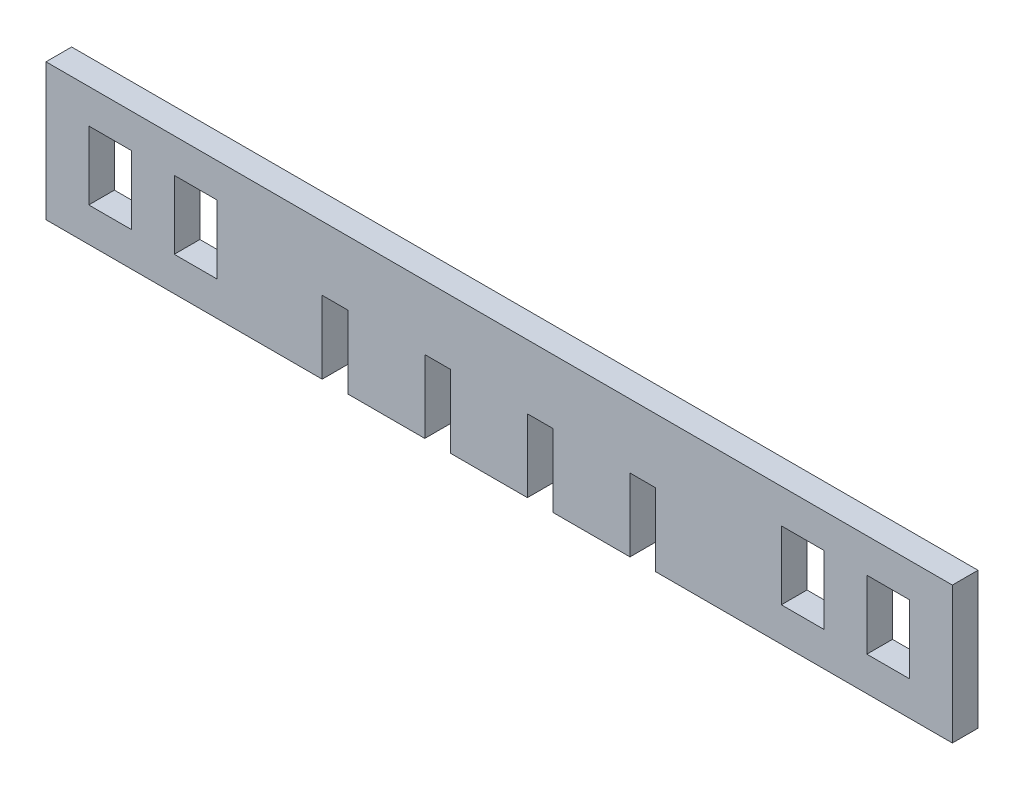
SolidWorks part; units mm, degrees
ref_plane "Alzado" through (0, 0, 0) normal (0, 0, 1) x (1, 0, 0)
ref_plane "Planta" through (0, 0, 0) normal (0, 1, 0) x (1, 0, 0)
ref_plane "Vista lateral" through (0, 0, 0) normal (1, 0, 0) x (0, 0, -1)
sketch "Sketch1" plane through (0, 0, 0) normal (0, 0, 1) x (1, 0, 0)
  line L0 (43, 4) -> (48, 4)
  line L1 (-53, -8) -> (-20.7, -8)
  line L2 (-53, -8) -> (-53, 8)
  line L3 (-53, 8) -> (53, 8)
  line L4 (53, -8) -> (53, 8)
  line L5 (-53, -8) -> (53, 8) construction
  line L6 (-53, 8) -> (53, -8) construction
  line L8 (18.3, -8) -> (18.3, 0.5)
  line L9 (18.3, 0.5) -> (15.3, 0.5)
  line L10 (15.3, -8) -> (15.3, 0.5)
  line L12 (6.3, -8) -> (6.3, 0.5)
  line L13 (6.3, 0.5) -> (3.3, 0.5)
  line L14 (3.3, -8) -> (3.3, 0.5)
  line L16 (-5.7, -8) -> (-5.7, 0.5)
  line L17 (-5.7, 0.5) -> (-8.7, 0.5)
  line L18 (-8.7, -8) -> (-8.7, 0.5)
  line L20 (-17.7, -8) -> (-17.7, 0.5)
  line L21 (-17.7, 0.5) -> (-20.7, 0.5)
  line L22 (-20.7, -8) -> (-20.7, 0.5)
  line L23 (-48, 4) -> (-43, 4)
  line L24 (-48, 4) -> (-48, -4)
  line L25 (-48, -4) -> (-43, -4)
  line L26 (-43, 4) -> (-43, -4)
  line L27 (-38, 4) -> (-33, 4)
  line L28 (-38, 4) -> (-38, -4)
  line L29 (-38, -4) -> (-33, -4)
  line L30 (-33, 4) -> (-33, -4)
  line L31 (43, 4) -> (43, -4)
  line L32 (43, -4) -> (48, -4)
  line L33 (48, 4) -> (48, -4)
  line L34 (33, 4) -> (38, 4)
  line L35 (33, 4) -> (33, -4)
  line L36 (33, -4) -> (38, -4)
  line L37 (38, 4) -> (38, -4)
  line L38 (-17.7, -8) -> (-8.7, -8)
  line L39 (-5.7, -8) -> (3.3, -8)
  line L40 (6.3, -8) -> (15.3, -8)
  line L41 (18.3, -8) -> (53, -8)
  point P0 (0, 0)
  dimension "D1" = 106
  dimension "D2" = 16
  dimension "D3" = 3
  dimension "D4" = 34.7
  dimension "D5" = 8.5
  dimension "D6" = 9
  dimension "D7" = 3
  dimension "D8" = 8.5
  dimension "D9" = 3
  dimension "D10" = 9
  dimension "D11" = 8.5
  dimension "D12" = 3
  dimension "D13" = 9
  dimension "D14" = 8.5
  dimension "D15" = 5
  dimension "D16" = 8
  dimension "D17" = 4
  dimension "D18" = 5
  dimension "D19" = 5
  dimension "D20" = 5
  dimension "D21" = 4
  dimension "D22" = 4
  dimension "D23" = 5
  dimension "D24" = 4
  dimension "D25" = 4
  dimension "D26" = 5
  dimension "D27" = 5
  dimension "D28" = 4
  dimension "D29" = 4
  dimension "D30" = 15.1109
extrude "Boss-Extrude1" add sketch "Sketch1" along normal blind 3
